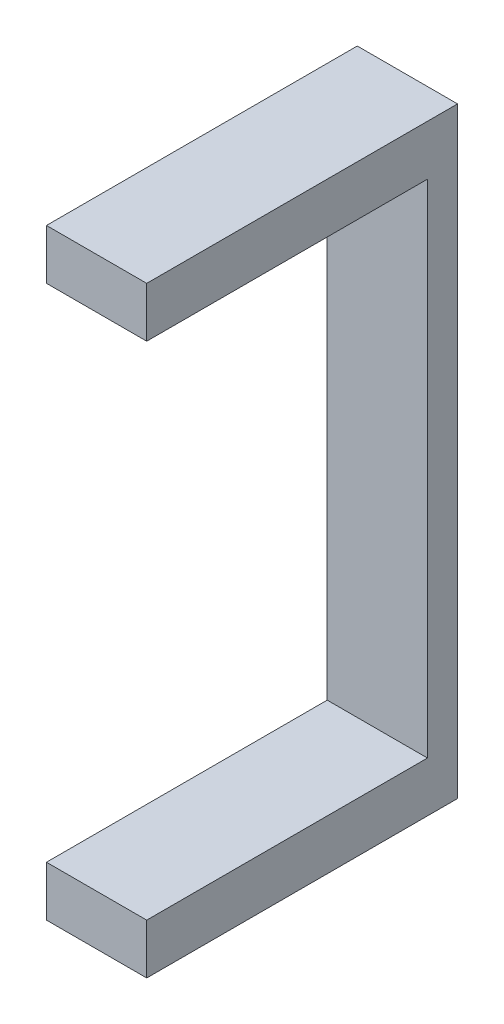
SolidWorks part; units mm, degrees
ref_plane "前视基准面" through (0, 0, 0) normal (0, 0, 1) x (1, 0, 0)
ref_plane "上视基准面" through (0, 0, 0) normal (0, 1, 0) x (1, 0, 0)
ref_plane "右视基准面" through (0, 0, 0) normal (1, 0, 0) x (0, 0, -1)
other "Configuration Table"
sketch "Hidden_keeper_bonding_foot_Sketch" plane through (0, 0, 0) normal (0, 0, 1) x (1, 0, 0)
  line L1 (-27.15, -6) -> (-25.15, -6)
  line L2 (-27.15, -6) -> (-27.15, 6)
  line L3 (-27.15, 6) -> (-25.15, 6)
  line L4 (-25.15, -6) -> (-25.15, 6)
extrude "Hidden_keeper_bonding_foot" add sketch "Hidden_keeper_bonding_foot_Sketch" along normal blind 0.6 from offset 2.6
sketch "Button_travel_stop_-5.5_Sketch" plane through (0, 0, 0) normal (0, 0, 1) x (1, 0, 0)
  line L1 (-27.15, -6) -> (-25.15, -6)
  line L2 (-27.15, -6) -> (-27.15, -5)
  line L3 (-27.15, -5) -> (-25.15, -5)
  line L4 (-25.15, -6) -> (-25.15, -5)
extrude "Button_travel_stop_-5.5" add sketch "Button_travel_stop_-5.5_Sketch" along normal blind 5.6 from offset 3.2
sketch "Button_travel_stop_5.5_Sketch" plane through (0, 0, 0) normal (0, 0, 1) x (1, 0, 0)
  line L1 (-27.15, 5) -> (-25.15, 5)
  line L2 (-27.15, 5) -> (-27.15, 6)
  line L3 (-27.15, 6) -> (-25.15, 6)
  line L4 (-25.15, 5) -> (-25.15, 6)
extrude "Button_travel_stop_5.5" add sketch "Button_travel_stop_5.5_Sketch" along normal blind 5.6 from offset 3.2
